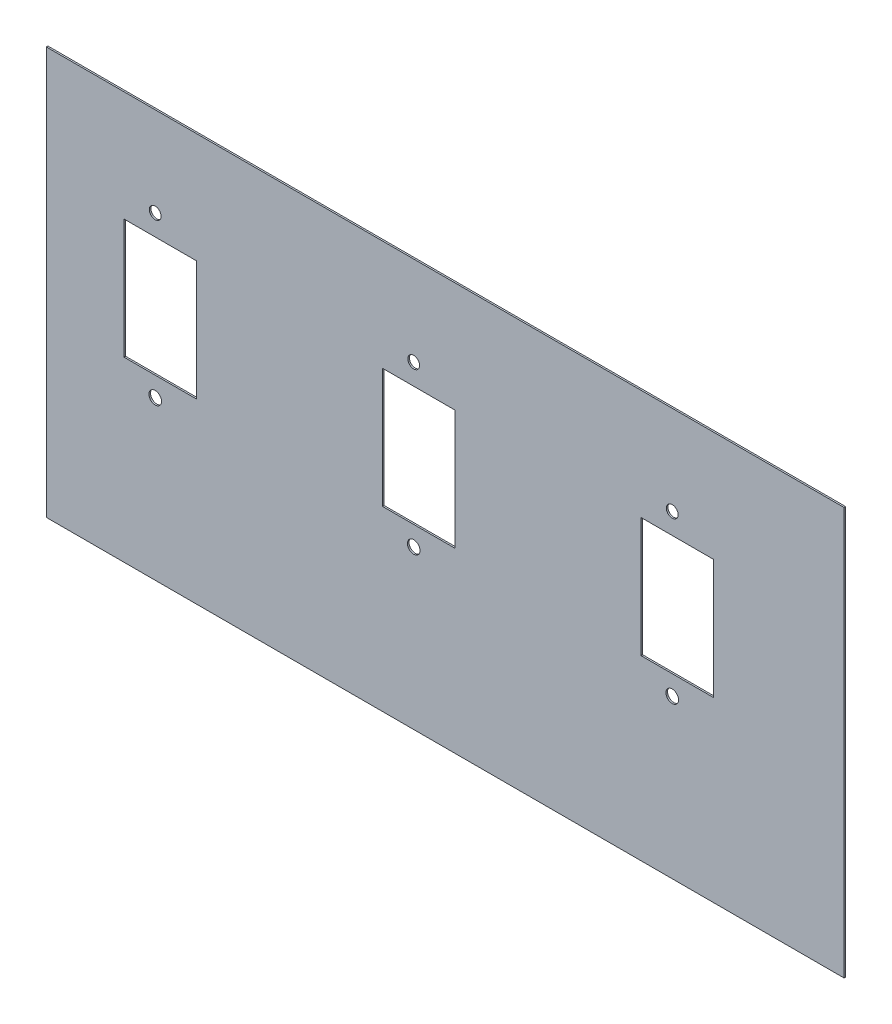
SolidWorks part; units mm, degrees
ref_plane "Front Plane" through (0, 0, 0) normal (0, 0, 1) x (1, 0, 0)
ref_plane "Top Plane" through (0, 0, 0) normal (0, 1, 0) x (1, 0, 0)
ref_plane "Right Plane" through (0, 0, 0) normal (1, 0, 0) x (0, 0, -1)
sketch "Sketch1" plane through (0, 0, 0) normal (0, 0, 1) x (1, 0, 0)
  line L1 (-292.9346, 286.4008) -> (969.0348, 286.4008)
  line L2 (-292.9346, 286.4008) -> (-292.9346, -1002.7914)
  line L3 (-292.9346, -1002.7914) -> (969.0348, -1002.7914)
  line L4 (969.0348, 286.4008) -> (969.0348, -1002.7914)
extrude "Extrude1" add sketch "Sketch1" along normal blind 2.54
sketch "Sketch2" plane through (0, 0, 2.54) normal (0, 0, 1) x (1, 0, 0)
  line L1 (-170.0737, 112.0966) -> (-55.6475, 112.0966)
  line L2 (-170.0737, 112.0966) -> (-170.0737, -77.1862)
  line L3 (-170.0737, -77.1862) -> (-55.6475, -77.1862)
  line L4 (-55.6475, 112.0966) -> (-55.6475, -77.1862)
extrude "Cut-Extrude1" cut sketch "Sketch2" against normal through all
sketch "Sketch3" plane through (0, 0, 2.54) normal (0, 0, 1) x (1, 0, 0)
  circle A0 centre (-120.6834, 145.099) radius 9.3347
  circle A1 centre (-120.6834, -108.0953) radius 9.9588
extrude "Cut-Extrude2" cut sketch "Sketch3" against normal through all
pattern_linear "LPattern1" count 2 spacing 762 along (0, -1, 0) count 3 spacing 408.94 along (1, 0, 0) of "Cut-Extrude1", "Cut-Extrude2"
sketch "Sketch4" plane through (0, 0, 2.54) normal (0, 0, 1) x (1, 0, 0)
  line L0 (-292.9346, -358.1953) -> (969.0348, -358.1953)
  line L1 (-292.9346, 286.4008) -> (-292.9346, -1002.7914) construction
  line L2 (969.0348, -1002.7914) -> (969.0348, 286.4008) construction
extrude "Cut-Extrude3" cut sketch "Sketch4" against normal through all and the other way through all flip side to cut
